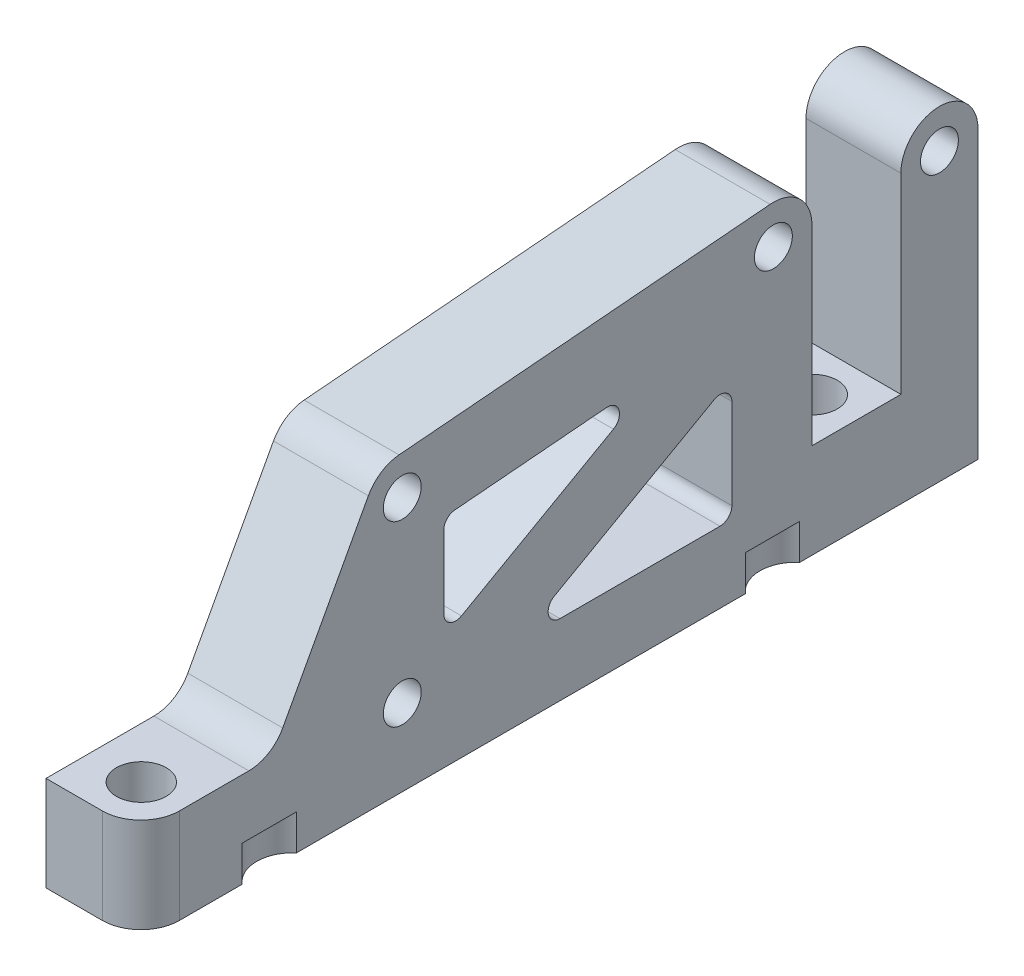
SolidWorks part; units mm, degrees
ref_plane "前视基准面" through (0, 0, 0) normal (0, 0, 1) x (1, 0, 0)
ref_plane "上视基准面" through (0, 0, 0) normal (0, 1, 0) x (1, 0, 0)
ref_plane "右视基准面" through (0, 0, 0) normal (1, 0, 0) x (0, 0, -1)
other "Configuration Table"
sketch "草图1" plane through (-24, 0, 0) normal (-1, 0, 0) x (0, 0, 1)
  line L0 (668.99, 143.3884) -> (702.0232, 140.5903)
  line L1 (651.4657, 140.15) -> (651.4657, 116)
  line L2 (739.4975, 116) -> (640.5025, 116) construction
  line L3 (651.4657, 116) -> (722.0343, 116)
  line L5 (711, 124) -> (702.0232, 140.5903)
  line L6 (657.9657, 140.15) -> (657.9657, 124)
  line L7 (657.9657, 124) -> (665.4657, 124)
  line L8 (665.4657, 124) -> (665.4657, 140.15)
  line L9 (711, 124) -> (722.0343, 124)
  line L10 (722.0343, 124) -> (722.0343, 116)
  circle A0 centre (654.7157, 140.15) radius 1.6
  circle A1 centre (668.7157, 140.15) radius 1.6
  circle A2 centre (700, 137.5) radius 1.6
  circle A3 centre (700, 122.5) radius 1.6
  arc A4 (651.4657, 140.15) -> (657.9657, 140.15) centre (654.7157, 140.15) cw
  arc A5 (665.4657, 140.15) -> (668.99, 143.3884) centre (668.7157, 140.15) cw
  dimension "D1" = 3.2
  dimension "D2" = 3.25
  dimension "D3" = 3.25
  dimension "D4" = 3.25
  dimension "D5" = 3.25
  dimension "D6" = 8
  dimension "D7" = 56.5685
  dimension "D8" = 11
extrude "凸台-拉伸1" add sketch "草图1" along normal blind 8
sketch "草图2" plane through (0, 116, 0) normal (0, -1, 0) x (1, 0, 0)
  circle A0 centre (-28.2843, 718.2843) radius 2.1
  circle A1 centre (-28.2843, 661.7157) radius 2.1
  dimension "D1" = 4.2
extrude "切除-拉伸1" cut sketch "草图2" against normal through all
sketch "草图3" plane through (0, 124, 0) normal (0, 1, 0) x (1, 0, 0)
  circle A0 centre (-33.9411, -668.7868) radius 3
  circle A1 centre (-33.9411, -711.2132) radius 3
  dimension "D1" = 6
  dimension "D2" = 6
extrude "切除-拉伸2" cut sketch "草图3" against normal through all from offset 5
fillet "圆角1" radius 3.25 2 edges at (-28, 124, 711) (-28, 140.5903, 702.0232)
fillet "圆角2" radius 3.25 1 edges at (-32, 120, 722.0343)
sketch "草图4" plane through (-32, 0, 0) normal (-1, 0, 0) x (0, 0, 1)
  line L0 (678.2031, 135.8338) -> (696.5, 134.2839)
  line L1 (696.5, 134.2839) -> (696.5, 125.5111)
  line L2 (696.5, 125.5111) -> (678.2031, 135.8338)
  line L3 (672.2157, 132.3228) -> (690.5126, 122)
  line L4 (690.5126, 122) -> (672.2157, 122)
  line L5 (672.2157, 122) -> (672.2157, 132.3228)
  line L6 (665.4657, 140.15) -> (665.4657, 124) construction
  line L7 (700.2743, 140.7384) -> (668.99, 143.3884) construction
  line L8 (651.4657, 116) -> (666.4994, 116) construction
  line L9 (668.7157, 140.15) -> (700, 122.5) construction
  dimension "D1" = 6.75
  dimension "D2" = 6
  dimension "D3" = 6
  dimension "D4" = 3.5
  dimension "D5" = 21.008
  dimension "D6" = 6.75
extrude "切除-拉伸3" cut sketch "草图4" against normal through all
fillet "圆角3" radius 1 6 edges at (-28, 135.8338, 678.2031) (-28, 134.2839, 696.5) (-28, 125.5111, 696.5) (-28, 132.3228, 672.2157) (-28, 122, 690.5126) (-28, 122, 672.2157)
mirror "镜向1" about plane through (0, 0, 0) normal (1, 0, 0)
sketch "草图5" plane through (-32, 0, 0) normal (-1, 0, 0) x (0, 0, 1)
  line L0 (651.4657, 140.15) -> (651.4657, 116) construction
  line L1 (646.4657, 145.15) -> (727.0343, 145.15)
  line L2 (646.4657, 145.15) -> (646.4657, 111)
  line L3 (646.4657, 111) -> (727.0343, 111)
  line L4 (727.0343, 145.15) -> (727.0343, 111)
  line L5 (671.0742, 116) -> (708.9258, 116) construction
  line L6 (722.0343, 124) -> (722.0343, 116) construction
  arc A0 (657.9657, 140.15) -> (651.4657, 140.15) centre (654.7157, 140.15) ccw construction
  dimension "D3" = 5
  dimension "D1" = 5
  dimension "D2" = 5
  dimension "D4" = 5
extrude "切除-拉伸4" cut sketch "草图5" against normal blind 10
